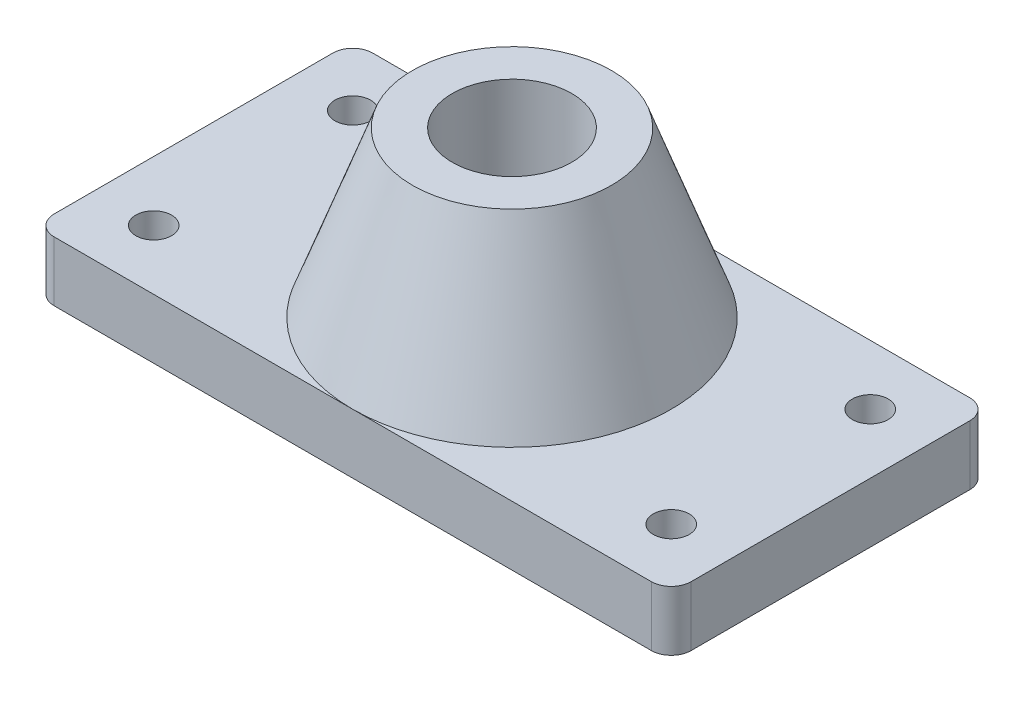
SolidWorks part; units mm, degrees
ref_plane "Ebene vorne" through (0, 0, 0) normal (0, 0, 1) x (1, 0, 0)
ref_plane "Ebene oben" through (0, 0, 0) normal (0, 1, 0) x (1, 0, 0)
ref_plane "Ebene rechts" through (0, 0, 0) normal (1, 0, 0) x (0, 0, -1)
sketch "Skizze1" plane through (0, 0, 0) normal (0, 1, 0) x (1, 0, 0)
  line L0 (0, 0) -> (-120.7588, 0) construction
  line L1 (0, 0) -> (0, -40)
  line L2 (0, -40) -> (-160, -40)
  line L3 (-160, -40) -> (-160, 40)
  line L4 (-160, 40) -> (0, 40)
  line L5 (0, 40) -> (0, 0)
  dimension "D1" = 80
  dimension "D2" = 160
extrude "Aufsatz-Linear austragen1" add sketch "Skizze1" along normal blind 15
sketch "Skizze2" plane through (0, 0, 0) normal (0, 0, 1) x (1, 0, 0)
  line L0 (-80, 0) -> (-80, 58.0734) construction
  line L5 (-95, 56.2122) -> (-95, 15)
  line L6 (-95, 15) -> (-120, 15)
  line L7 (-120, 15) -> (-105, 56.2122)
  line L8 (-105, 56.2122) -> (-95, 56.2122)
  line L10 (0, 15) -> (-160, 15) construction
  point P2 (0, 0)
  point P9 (0, 0)
  point P12 (0, 0)
  point P13 (-163.982, -12.452)
  point P14 (0, 0)
  point P15 (0, 0)
  point P16 (0, 0)
  dimension "D1" = 80
  dimension "D2" = 40
  dimension "D3" = 30
  dimension "D4" = 50
revolve "Rotation1" add sketch "Skizze2" angle 360 about L0
hole_wizard "Stirnsenkung für M8 Zylinderschraube mit Innensechskant1" positions "3D-Skizze1" profile "Skizze3" counterbore size "M8" standard "DIN"
sketch3d "3D-Skizze1"
  line L0 (-160, 0, 40) -> (0, 0, 40) construction
  line L1 (-160, 0, -40) -> (-160, 0, 40) construction
  point P0 (-145, 0, 25)
  dimension "D1" = 15
  dimension "D2" = 15
sketch "Skizze3" plane through (-145, 0, 25) normal (1, 0, 0) x (0, 0, -1)
  line L0 (0, 0) -> (0, 56.2122)
  line L1 (0, 56.2122) -> (4.5, 56.2122)
  line L3 (4.5, 56.2122) -> (4.5, 8.6)
  line L4 (4.5, 8.6) -> (7.5, 8.6)
  line L5 (7.5, 8.6) -> (7.5, 0)
  line L7 (7.5, 0) -> (0, 0)
  line L11 (0, -6.35) -> (0, 107.95) construction
  dimension "Bohrerdurchmesser" = 9
  dimension "Bohrungstiefe" = 56.2122
  dimension "Senkdurchmesser2" = 15
  dimension "Senktiefe2" = 8.6
ref_plane "Ebene1" through (-80, 0, 0) normal (1, 0, 0) x (0, 0, -1)
mirror "Spiegeln1" about plane through (-80, 0, 0) normal (1, 0, 0) of "Stirnsenkung für M8 Zylinderschraube mit Innensechskant1"
mirror "Spiegeln2" about plane through (0, 0, 0) normal (0, 0, 1) of "Spiegeln1", "Stirnsenkung für M8 Zylinderschraube mit Innensechskant1"
fillet "Verrundung1" radius 5 4 edges at (-160, 7.5, -40) (-160, 7.5, 40) (0, 7.5, -40) (0, 7.5, 40)
sketch "Skizze4" plane through (0, 15, 0) normal (0, 1, 0) x (1, 0, 0)
  circle A1 centre (-80, 0) radius 15
  circle A2 centre (-80, 0) radius 15
  dimension "D1" = 0
extrude "Schnitt-Linear austragen1" cut sketch "Skizze4" against normal through all
